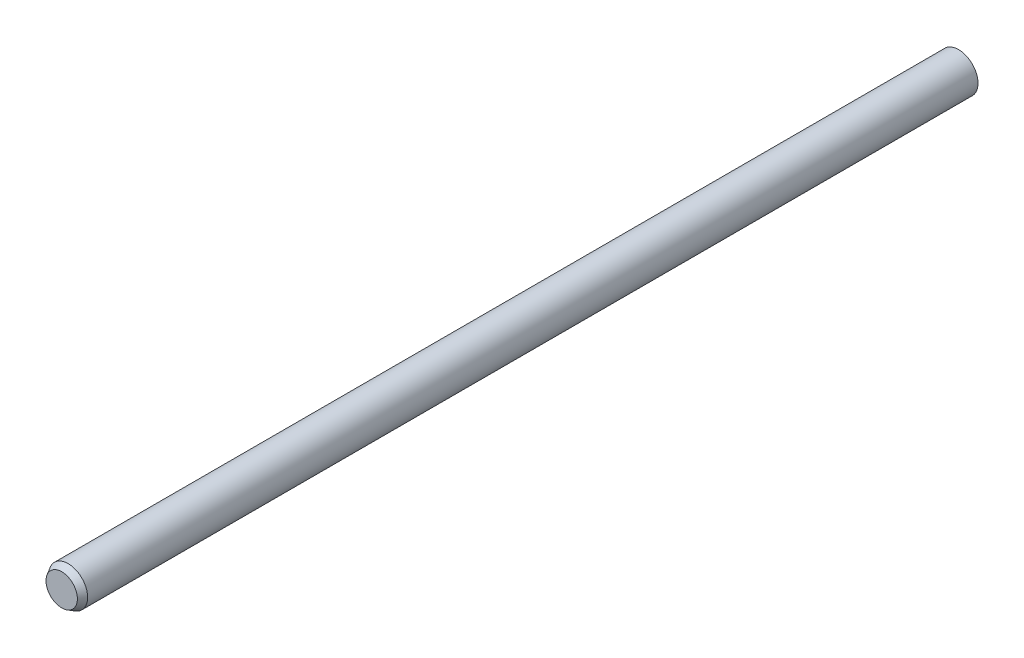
SolidWorks part; units mm, degrees
ref_plane "Face" through (0, 0, 0) normal (0, 0, 1) x (1, 0, 0)
ref_plane "Dessus" through (0, 0, 0) normal (0, 1, 0) x (1, 0, 0)
ref_plane "Droite" through (0, 0, 0) normal (1, 0, 0) x (0, 0, -1)
sketch "Esquisse1" plane through (0, 0, 0) normal (0, 0, 1) x (1, 0, 0)
  circle A0 centre (0, 0) radius 6
  dimension "D1" = 12
extrude "Base-Extrusion" add sketch "Esquisse1" along normal blind 278
chamfer "Chanfrein1" distance 2 angle 30
